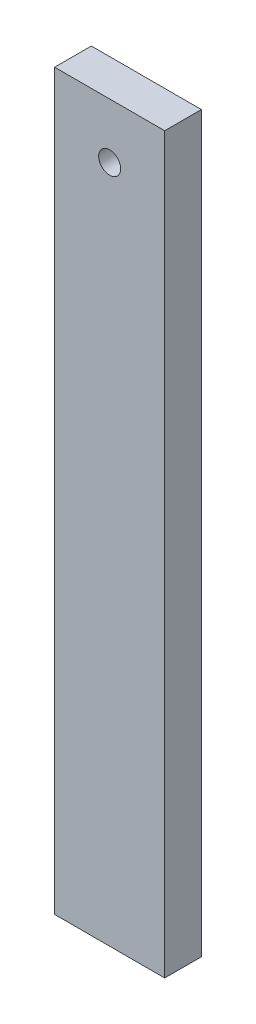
SolidWorks part; units mm, degrees
ref_plane "Plan de face" through (0, 0, 0) normal (0, 0, 1) x (1, 0, 0)
ref_plane "Plan de dessus" through (0, 0, 0) normal (0, 1, 0) x (1, 0, 0)
ref_plane "Plan de droite" through (0, 0, 0) normal (1, 0, 0) x (0, 0, -1)
sketch "Esquisse1" plane through (0, 0, 0) normal (0, 0, 1) x (1, 0, 0)
  line L1 (0, 0) -> (150, 0)
  line L2 (0, 0) -> (0, 1000)
  line L3 (0, 1000) -> (150, 1000)
  line L4 (150, 0) -> (150, 1000)
  circle A0 centre (75, 925) radius 15
  dimension "D3" = 30
  dimension "D1" = 1000
  dimension "D2" = 150
  dimension "D4" = 75
  dimension "D5" = 75
extrude "Boss.-Extru.1" add sketch "Esquisse1" along normal blind 50
